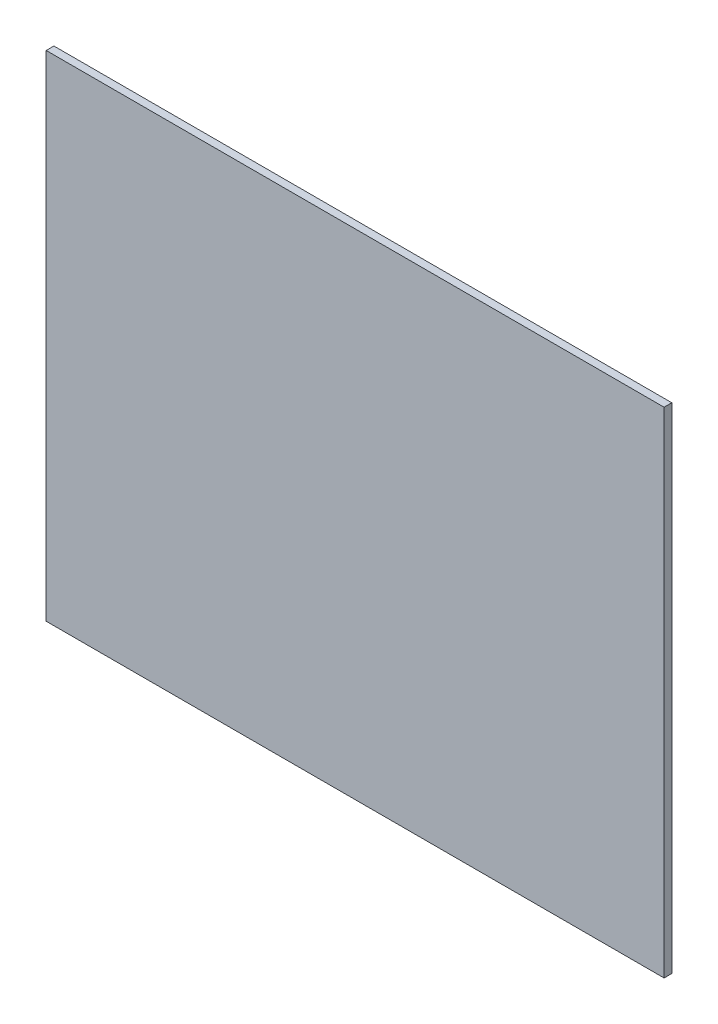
SolidWorks part; units mm, degrees
ref_plane "Front Plane" through (0, 0, 0) normal (0, 0, 1) x (1, 0, 0)
ref_plane "Top Plane" through (0, 0, 0) normal (0, 1, 0) x (1, 0, 0)
ref_plane "Right Plane" through (0, 0, 0) normal (1, 0, 0) x (0, 0, -1)
sketch "Sketch1" plane through (0, 0, 0) normal (0, 0, 1) x (1, 0, 0)
  line L1 (-65.8958, 388.5405) -> (188.1032, 388.5405)
  line L2 (-65.8958, 388.5405) -> (-65.8958, 591.7405)
  line L3 (-65.8958, 591.7405) -> (188.1032, 591.7405)
  line L4 (188.1032, 388.5405) -> (188.1032, 591.7405)
  dimension "D1" = 203.2
  dimension "D2" = 253.999
extrude "Boss-Extrude1" add sketch "Sketch1" along normal blind 3.175 contours L2 L3 L4 L1
